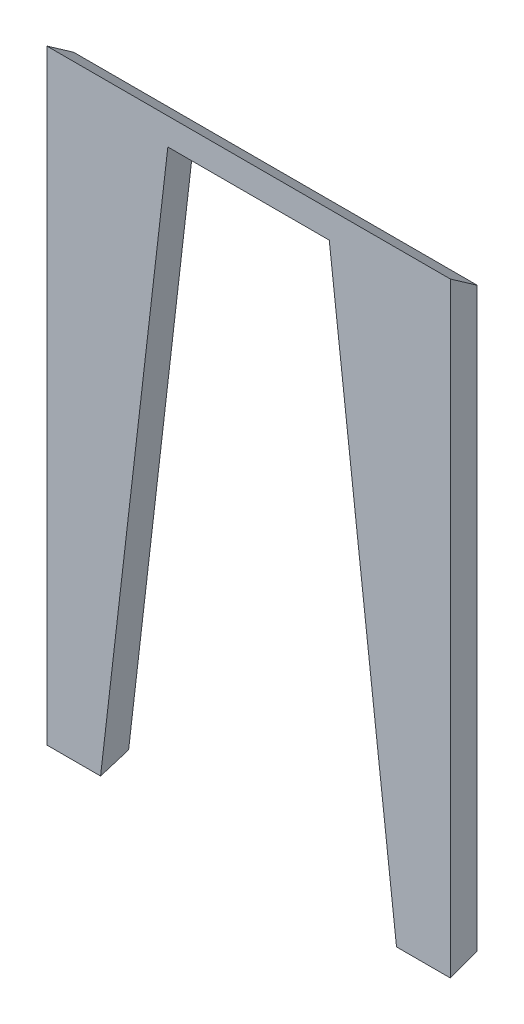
SolidWorks part; units mm, degrees
ref_plane "Plan de face" through (0, 0, 0) normal (0, 0, 1) x (1, 0, 0)
ref_plane "Plan de dessus" through (0, 0, 0) normal (0, 1, 0) x (1, 0, 0)
ref_plane "Plan de droite" through (0, 0, 0) normal (1, 0, 0) x (0, 0, -1)
sketch "Esquisse1" plane through (0, 0, 0) normal (0, 0, 1) x (1, 0, 0)
  line L0 (0, 0) -> (300, 0)
  line L1 (300, 0) -> (300, -450)
  line L2 (300, -450) -> (260, -450)
  line L3 (260, -450) -> (210, -20)
  line L4 (210, -20) -> (90, -20)
  line L5 (90, -20) -> (40, -450)
  line L6 (40, -450) -> (0, -450)
  line L7 (0, -450) -> (0, 0)
  line L8 (150, 0) -> (150, -20) construction
  dimension "D1" = 300
  dimension "D2" = 450
  dimension "D3" = 120
  dimension "D4" = 20
  dimension "D5" = 40
extrude "Boss.-Extru.1" add sketch "Esquisse1" along normal mid plane 20
sketch "Esquisse2" plane through (300, 0, 0) normal (1, 0, 0) x (0, 0, -1)
  line L0 (-10, 0) -> (10, -14.0042)
  line L1 (10, -450) -> (10, 0) construction
  line L2 (10, -14.0042) -> (10, 0)
  line L3 (10, 0) -> (-10, 0)
  line L4 (-10, -450) -> (10, -442.7206)
  line L5 (10, -442.7206) -> (10, -450)
  line L6 (10, -450) -> (-10, -450)
  dimension "D1" = 35
  dimension "D2" = 20
extrude "Enlèv. mat.-Extru.3" cut sketch "Esquisse2" against normal through all
